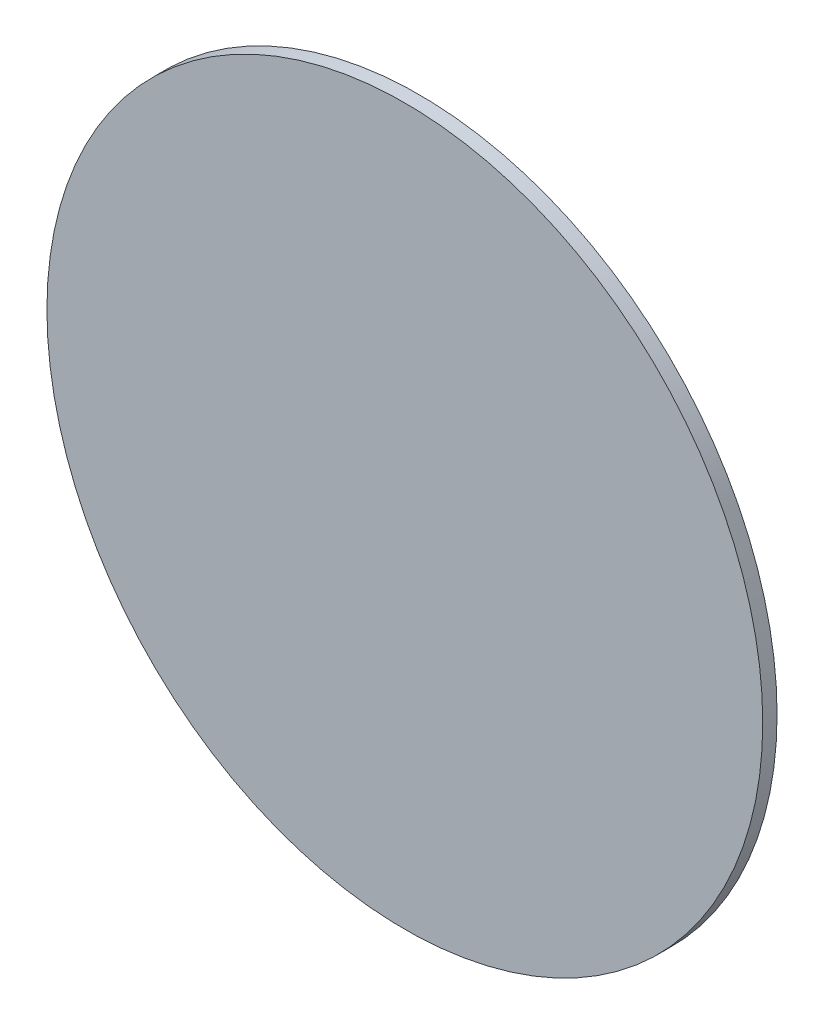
SolidWorks part; units mm, degrees
ref_plane "Front" through (0, 0, 0) normal (0, 0, 1) x (1, 0, 0)
ref_plane "Top" through (0, 0, 0) normal (0, 1, 0) x (1, 0, 0)
ref_plane "Right" through (0, 0, 0) normal (1, 0, 0) x (0, 0, -1)
sketch "Sketch1" plane through (0, 0, 0) normal (0, 0, 1) x (1, 0, 0)
  circle A0 centre (0, 0) radius 12.5
  dimension "D1" = 25
extrude "Extrude1" add sketch "Sketch1" along normal blind 0.5
